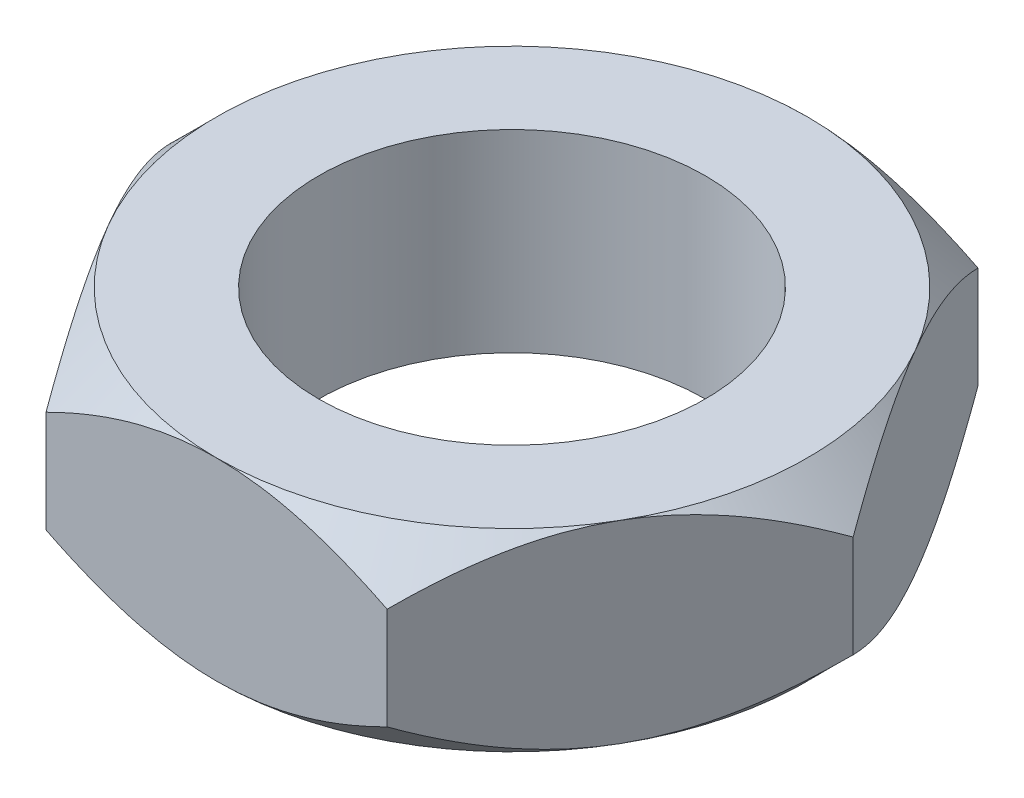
SolidWorks part; units mm, degrees
ref_plane "Face" through (0, 0, 0) normal (0, 0, 1) x (1, 0, 0)
ref_plane "Dessus" through (0, 0, 0) normal (0, 1, 0) x (1, 0, 0)
ref_plane "Coté" through (0, 0, 0) normal (1, 0, 0) x (0, 0, -1)
sketch "Esquisse1" plane through (0, 0, 0) normal (0, 1, 0) x (1, 0, 0)
  line L0 (-77.0213, 0) -> (92.0353, 0) construction
  line L1 (31.7543, 0) -> (15.8771, 27.5)
  line L2 (31.7543, 0) -> (15.8771, -27.5)
  line L3 (0, 76.4208) -> (0, -85.7294) construction
  line L4 (-31.7543, 0) -> (-15.8771, -27.5)
  line L5 (-31.7543, 0) -> (-15.8771, 27.5)
  line L6 (-15.8771, 27.5) -> (15.8771, 27.5)
  line L7 (-15.8771, -27.5) -> (15.8771, -27.5)
  circle A0 centre (0, 0) radius 18
  dimension "Diamètre" = 36
  dimension "D1" = 120
  dimension "Cote sur plat" = 55
extrude "Base-Extrusion" add sketch "Esquisse1" along normal blind 18
sketch "Esquisse2" plane through (0, 18, 0) normal (0, 1, 0) x (-1, 0, 0)
  line L0 (-31.7543, 0) -> (-15.8771, 27.5) construction
  circle A0 centre (0, 0) radius 27.5
extrude "Enlèv. mat.-Extru.2" cut sketch "Esquisse2" against normal through all draft 45 flip side to cut
sketch "Esquisse3" plane through (0, 0, 0) normal (0, -1, 0) x (1, 0, 0)
  line L0 (31.7543, 0) -> (15.8771, -27.5) construction
  circle A0 centre (0, 0) radius 27.5
extrude "Enlèv. mat.-Extru.3" cut sketch "Esquisse3" against normal through all draft 45 flip side to cut
